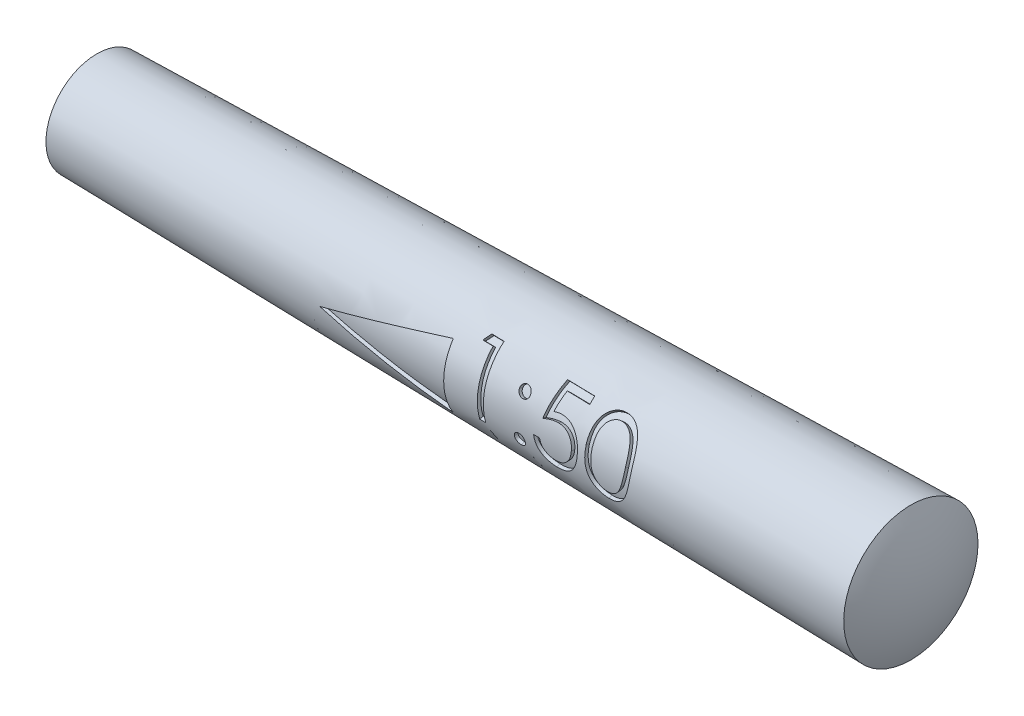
SolidWorks part; units mm, degrees
ref_plane "Front Plane" through (0, 0, 0) normal (0, 0, 1) x (1, 0, 0)
ref_plane "Top Plane" through (0, 0, 0) normal (0, 1, 0) x (1, 0, 0)
ref_plane "Right Plane" through (0, 0, 0) normal (1, 0, 0) x (0, 0, -1)
sketch "Sketch1" plane through (0, 0, 0) normal (1, 0, 0) x (0, 0, -1)
  circle A0 centre (0, 0) radius 0.75
  dimension "D1" = 1.5
extrude "Extrude1" add sketch "Sketch1" along normal mid plane 12
draft "Draft1" type of draft neutral plane draft angle 1.146 faces to draft 1 parameters "D1"=1.146
sketch "Sketch2" plane through (0, 0, 0) normal (0, 0, 1) x (1, 0, 0)
  line L0 (-6, 0) -> (-6, 0.75)
  line L1 (-6, 0.75) -> (-6, -0.75) construction
  line L2 (-6, 0) -> (-6.23, 0)
  line L3 (-6.23, 0) -> (-6.23, -0.87) construction
  line L4 (6, 0) -> (6, 0.99)
  line L5 (6, -0.99) -> (6, 0.99) construction
  line L6 (6, 0) -> (6.23, 0)
  line L7 (6.23, 0) -> (6.23, -0.87) construction
  line L8 (-6, -0.75) -> (6, -0.99) construction
  arc A0 (-6.23, 0) -> (-6, 0.75) centre (-4.8922, 0) cw
  arc A1 (6.23, 0) -> (6, 0.99) centre (3.9843, 0) ccw
  point P14 (0, -0.87)
revolve "Revolve1" add sketch "Sketch2" angle 360 about L2
sketch "Sketch5" plane through (0, 0, 0) normal (0, 0, 1) x (1, 0, 0)
  line L0 (0, 0.87) -> (0, -0.87) construction
  line L1 (6, 0.99) -> (-6, 0.75) construction
  line L2 (-6, -0.75) -> (6, -0.99) construction
ref_plane "Plane2" through (0, 0, 0) normal (-0.02, 0, 0.9998) x (0.9998, 0, 0.02)
sketch "Sketch6" plane through (0, 0, 0) normal (-0.02, 0, 0.9998) x (0.9998, 0, 0.02)
  line L0 (0, 0) -> (0, 0.5)
  line L1 (0, 0.87) -> (0, -0.87) construction
  line L2 (0, 0.5) -> (-1.866, 0)
  line L3 (-1.866, 0) -> (0, -0.5)
  line L4 (0, -0.5) -> (0, 0)
  line L5 (0, -0.25) -> (3, -0.25) construction
  text T0 "1:50" font "Century Gothic" height 1
  dimension "D1" = 1
  dimension "D2" = 30
  dimension "D3" = 3
wrap "Wrap2" sketch "Sketch6" wrap type deboss source sketch "Sketch6" thickness 0.05 parameters "D1"=0.05
equation "\"D2@Sketch2\" = \"D1@Sketch2\""
